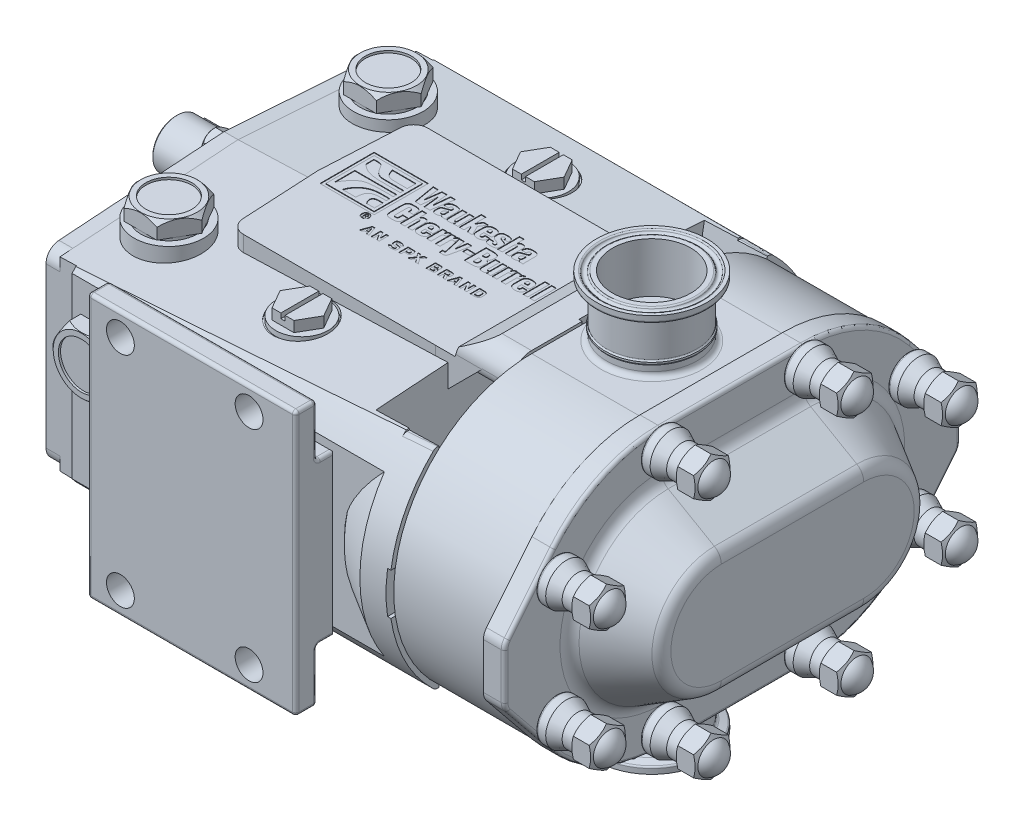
SolidWorks part; units mm, degrees
ref_plane "Front Plane" through (0, 0, 0) normal (0, 0, 1) x (1, 0, 0)
ref_plane "Top Plane" through (0, 0, 0) normal (0, 1, 0) x (1, 0, 0)
ref_plane "Right Plane" through (0, 0, 0) normal (1, 0, 0) x (0, 0, -1)
other "Join1"
other "cleanout plug<2>@018_U2_Upper Shaft"
other "grease fitting<7>@018_U2_Upper Shaft"
other "grease fitting<3>@018_U2_Upper Shaft"
other "cleanout plug<1>@018_U2_Upper Shaft"
other "grease fitting<6>@018_U2_Upper Shaft"
other "grease fitting<1>@018_U2_Upper Shaft"
other "oil plug<6>@018_U2_Upper Shaft"
other "oil plug<5>@018_U2_Upper Shaft"
other "oil plug<4>@018_U2_Upper Shaft"
other "oil plug<3>@018_U2_Upper Shaft"
other "oil plug<2>@018_U2_Upper Shaft"
other "Key<1>@018_U2_Upper Shaft"
other "Shaft<1>@018_U2_Upper Shaft"
other "oil plug<1>@018_U2_Upper Shaft"
other "108369<8>@018_U2_Upper Shaft"
other "108369<7>@018_U2_Upper Shaft"
other "108369<6>@018_U2_Upper Shaft"
other "108369<5>@018_U2_Upper Shaft"
other "108369<4>@018_U2_Upper Shaft"
other "108369<3>@018_U2_Upper Shaft"
other "108369<2>@018_U2_Upper Shaft"
other "108369<1>@018_U2_Upper Shaft"
other "101842<1>@018_U2_Upper Shaft"
other "101865<1>@018_U2_Upper Shaft"
other "020110000<1>@018_U2_Upper Shaft"
other "plate<1>@018_U2_Upper Shaft"
other "102276<1>@018_U2_Upper Shaft"
other "030360005<2>@018_U2_Upper Shaft"
other "030360005<1>@018_U2_Upper Shaft"
